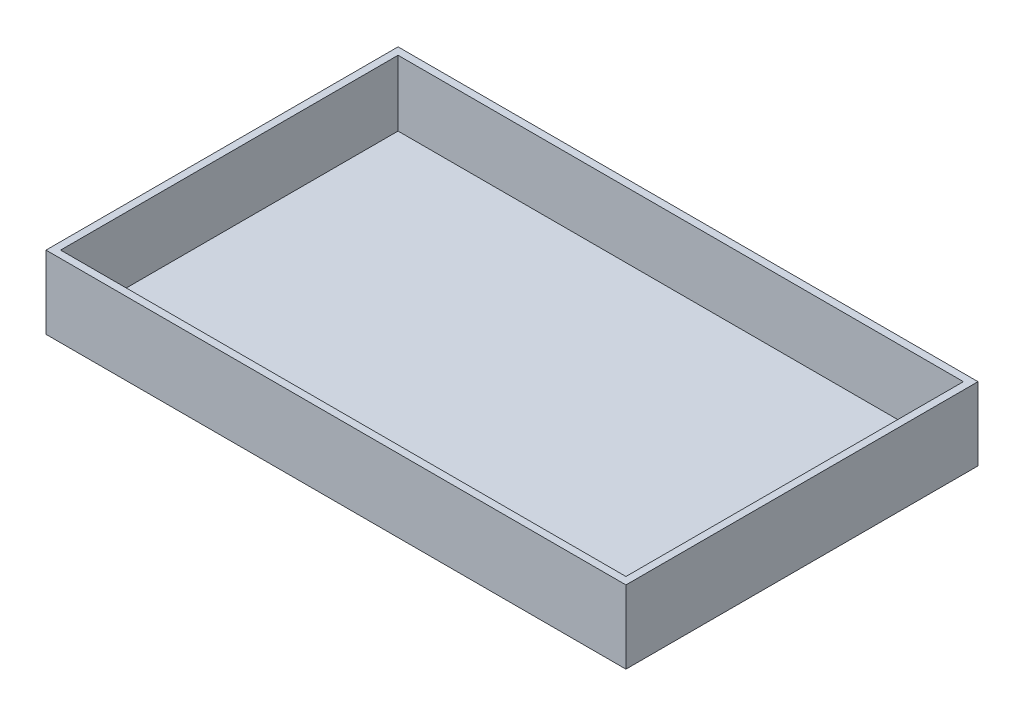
SolidWorks part; units mm, degrees
ref_plane "Front" through (0, 0, 0) normal (0, 0, 1) x (1, 0, 0)
ref_plane "Top" through (0, 0, 0) normal (0, 1, 0) x (1, 0, 0)
ref_plane "Right" through (0, 0, 0) normal (1, 0, 0) x (0, 0, -1)
sketch "Sketch1" plane through (0, 0, 0) normal (0, 1, 0) x (1, 0, 0)
  line L1 (-78.3592, 48.4368) -> (80.6033, 48.4368)
  line L2 (-78.3592, 48.4368) -> (-78.3592, -48.0628)
  line L3 (-78.3592, -48.0628) -> (80.6033, -48.0628)
  line L4 (80.6033, 48.4368) -> (80.6033, -48.0628)
extrude "Extrude1" add sketch "Sketch1" along normal blind 20
shell "Shell1" thickness 2
ref_plane "Plane1" through (0, 16.3738, 0) normal (0, 1, 0) x (-1, 0, 0)
sketch "Sketch4" plane through (0, 16.3738, 0) normal (0, 1, 0) x (-1, 0, 0)
  line L0 (76.3592, -25.5823) -> (-5.54, -25.5823)
  line L1 (76.3592, -46.4368) -> (76.3592, 46.0628) construction
  line L2 (-35.924, 25.5327) -> (34.0808, 25.5327)
  arc A0 (-5.54, -25.5823) -> (-23.5402, -1.9073) centre (-5.54, -6.9021) cw
  arc A1 (34.0808, 25.5327) -> (43.9429, 6.6156) centre (34.0808, 13.5035) cw
